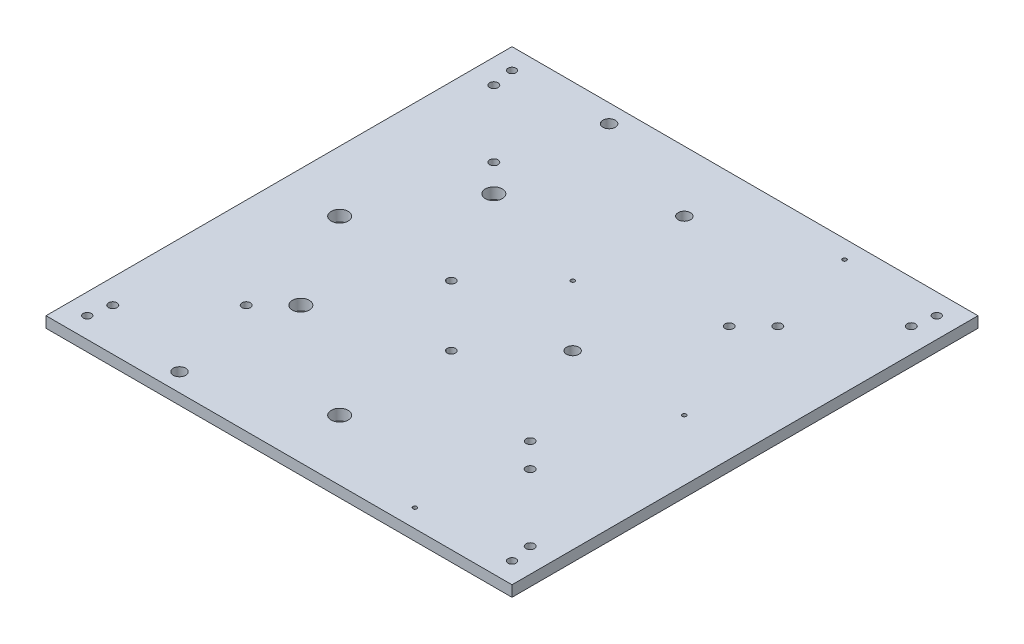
SolidWorks part; units mm, degrees
ref_plane "Front Plane" through (0, 0, 0) normal (0, 0, 1) x (1, 0, 0)
ref_plane "Top Plane" through (0, 0, 0) normal (0, 1, 0) x (1, 0, 0)
ref_plane "Right Plane" through (0, 0, 0) normal (1, 0, 0) x (0, 0, -1)
sketch "Sketch1" plane through (0, 0, 0) normal (0, 1, 0) x (1, 0, 0)
  line L1 (0, 0) -> (384, 0)
  line L2 (0, 0) -> (0, 384)
  line L3 (0, 384) -> (384, 384)
  line L4 (384, 0) -> (384, 384)
  dimension "D1" = 384
  dimension "D2" = 384
extrude "Boss-Extrude1" add sketch "Sketch1" along normal blind 8.99
sketch "Sketch2" plane through (0, 8.99, 0) normal (0, 1, 0) x (1, 0, 0)
  line L0 (0, 0) -> (384, 0) construction
  line L1 (10, 25) -> (85, 25)
  line L2 (10, 25) -> (10, 100)
  line L3 (10, 100) -> (85, 100)
  line L4 (85, 25) -> (85, 100)
  line L5 (0, 384) -> (0, 0) construction
  line L6 (0, 192) -> (384, 192) construction
  line L7 (384, 0) -> (384, 384) construction
  line L8 (192, 384) -> (192, 0) construction
  line L9 (384, 384) -> (0, 384) construction
  line L10 (10, 284) -> (85, 284)
  line L11 (85, 359) -> (85, 284)
  line L12 (10, 359) -> (85, 359)
  line L13 (10, 359) -> (10, 284)
  line L14 (374, 100) -> (299, 100)
  line L15 (299, 25) -> (299, 100)
  line L16 (374, 25) -> (299, 25)
  line L17 (374, 25) -> (374, 100)
  line L18 (374, 359) -> (374, 284)
  line L19 (374, 359) -> (299, 359)
  line L20 (299, 359) -> (299, 284)
  line L21 (374, 284) -> (299, 284)
  dimension "D1" = 75
  dimension "D2" = 75
  dimension "D3" = 25
  dimension "D4" = 10
sketch "Sketch3" plane through (0, 8.99, 0) normal (0, 1, 0) x (1, 0, 0)
  line L8 (0, 192) -> (384, 192) construction
  line L9 (0, 384) -> (0, 0) construction
  line L10 (384, 0) -> (384, 384) construction
  line L11 (192, 384) -> (192, 0) construction
  line L12 (384, 384) -> (0, 384) construction
  line L13 (0, 0) -> (384, 0) construction
  line L14 (85, 359) -> (85, 284) construction
  line L15 (10, 284) -> (85, 284) construction
  line L16 (299, 359) -> (299, 284) construction
  line L17 (374, 284) -> (299, 284) construction
  line L18 (374, 25) -> (299, 25) construction
  line L19 (299, 25) -> (299, 100) construction
  line L20 (85, 25) -> (85, 100) construction
  line L21 (10, 25) -> (85, 25) construction
  circle A0 centre (95, 15) radius 6
  circle A1 centre (97.5, 271.5) radius 8
  circle A2 centre (289, 274) radius 4
  circle A3 centre (289, 15) radius 2
  circle A4 centre (50, 192) radius 8
  circle A5 centre (142, 192) radius 4
  circle A6 centre (242, 192) radius 6
  circle A7 centre (334, 192) radius 2
  dimension "D1" = 12
  dimension "D4" = 16
  dimension "D7" = 8
  dimension "D8" = 4
  dimension "D13" = 16
  dimension "D14" = 8
  dimension "D15" = 12
  dimension "D16" = 4
  dimension "D19" = 50
  dimension "D3" = 10
  dimension "D5" = 12.5
  dimension "D6" = 12.5
  dimension "D9" = 10
  dimension "D10" = 10
  dimension "D11" = 10
  dimension "D12" = 10
  dimension "D17" = 50
  dimension "D18" = 50
  dimension "D20" = 50
  dimension "D21" = 10
sketch "Sketch4" plane through (0, 8.99, 0) normal (0, 1, 0) x (1, 0, 0)
  line L8 (192, 384) -> (192, 0) construction
  line L9 (384, 384) -> (0, 384) construction
  line L10 (0, 0) -> (384, 0) construction
  line L11 (0, 192) -> (384, 192) construction
  line L12 (0, 384) -> (0, 0) construction
  line L13 (384, 0) -> (384, 384) construction
  line L14 (85, 359) -> (85, 284) construction
  line L15 (10, 359) -> (85, 359) construction
  line L16 (299, 359) -> (299, 284) construction
  line L17 (374, 359) -> (299, 359) construction
  line L18 (299, 25) -> (299, 100) construction
  line L19 (374, 100) -> (299, 100) construction
  line L20 (10, 100) -> (85, 100) construction
  line L21 (85, 25) -> (85, 100) construction
  circle A0 centre (97.5, 112.5) radius 8
  circle A1 centre (289, 110) radius 4
  circle A2 centre (289, 369) radius 2
  circle A3 centre (95, 369) radius 6
  circle A5 centre (192, 334) radius 6
  circle A6 centre (192, 242) radius 2
  circle A7 centre (192, 142) radius 4
  circle A8 centre (192, 50) radius 8
  dimension "D9" = 16
  dimension "D10" = 8
  dimension "D11" = 4
  dimension "D12" = 12
  dimension "D13" = 12
  dimension "D14" = 4
  dimension "D15" = 8
  dimension "D16" = 16
  dimension "D3" = 10
  dimension "D4" = 10
  dimension "D5" = 10
  dimension "D6" = 10
  dimension "D7" = 12.5
  dimension "D8" = 12.5
  dimension "D17" = 50
  dimension "D18" = 50
  dimension "D19" = 50
  dimension "D20" = 50
  dimension "D21" = 10
  dimension "D22" = 10
sketch "Sketch5" plane through (0, 8.99, 0) normal (0, 1, 0) x (1, 0, 0)
  line L0 (0, 384) -> (0, 0) construction
  line L1 (384, 384) -> (0, 384) construction
  point P0 (17, 17)
  point P1 (17, 367)
  point P2 (367, 367)
  point P3 (367, 17)
  dimension "D1" = 350
  dimension "D2" = 350
  dimension "D3" = 350
  dimension "D4" = 350
  dimension "D5" = 17
  dimension "D6" = 17
hole_wizard "M6 Clearance Hole1" positions "Sketch5" profile "Sketch6" hole size "M6" standard "ANSI Metric"
sketch "Sketch6" plane through (17, 8.99, -17) normal (1, 0, 0) x (0, 0, 1)
  line L0 (0, 0) -> (0, 8.99)
  line L1 (0, 8.99) -> (3.3, 8.99)
  line L2 (3.3, 8.99) -> (3.3, 0)
  line L5 (3.3, 0) -> (0, 0)
  line L11 (0, -6.35) -> (0, 107.95) construction
  dimension "Thru Hole Dia." = 6.6
  dimension "Thru Hole Depth" = 8.99
sketch "M16_Sketch" plane through (0, 8.99, 0) normal (0, 1, 0) x (1, 0, 0)
  point P0 (50, 192)
  point P1 (97.5, 271.5)
  point P3 (192, 50)
  point P5 (97.5, 112.5)
sketch "M12_Sketch" plane through (0, 8.99, 0) normal (0, 1, 0) x (1, 0, 0)
  point P0 (242, 192)
  point P1 (192, 334)
  point P3 (95, 369)
  point P5 (95, 15)
sketch "M8_Sketch" plane through (0, 8.99, 0) normal (0, 1, 0) x (1, 0, 0)
  point P0 (142, 192)
  point P1 (289, 110)
  point P3 (289, 274)
  point P5 (192, 142)
sketch "M4_Sketch" plane through (0, 8.99, 0) normal (0, 1, 0) x (1, 0, 0)
  point P0 (192, 242)
  point P1 (334, 192)
  point P3 (289, 369)
  point P5 (289, 15)
hole_wizard "Tap Drill for M8x1.25 Tap1" positions "M8_Sketch" profile "Sketch14" hole size "M8x1.25" standard "ANSI Metric"
sketch "Sketch14" plane through (142, 8.99, -192) normal (1, 0, 0) x (0, 0, 1)
  line L0 (0, 0) -> (0, 8.99)
  line L1 (0, 8.99) -> (3.4, 8.99)
  line L2 (3.4, 8.99) -> (3.4, 0)
  line L5 (3.4, 0) -> (0, 0)
  line L11 (0, -6.35) -> (0, 107.95) construction
  dimension "Thru Hole Dia." = 6.8
  dimension "Thru Hole Depth" = 8.99
hole_wizard "Tap Drill for M4x0.7 Tap1" positions "M4_Sketch" profile "Sketch15" hole size "M4x0.7" standard "ANSI Metric"
sketch "Sketch15" plane through (192, 8.99, -242) normal (1, 0, 0) x (0, 0, 1)
  line L0 (0, 0) -> (0, 8.99)
  line L1 (0, 8.99) -> (1.65, 8.99)
  line L2 (1.65, 8.99) -> (1.65, 0)
  line L5 (1.65, 0) -> (0, 0)
  line L11 (0, -6.35) -> (0, 107.95) construction
  dimension "Thru Hole Dia." = 3.3
  dimension "Thru Hole Depth" = 8.99
hole_wizard "Tap Drill for M12x1.75 Tap1" positions "M12_Sketch" profile "Sketch16" hole size "M12x1.75" standard "ANSI Metric"
sketch "Sketch16" plane through (242, 8.99, -192) normal (1, 0, 0) x (0, 0, 1)
  line L0 (0, 0) -> (0, 8.99)
  line L1 (0, 8.99) -> (5.1, 8.99)
  line L2 (5.1, 8.99) -> (5.1, 0)
  line L5 (5.1, 0) -> (0, 0)
  line L11 (0, -6.35) -> (0, 107.95) construction
  dimension "Thru Hole Dia." = 10.2
  dimension "Thru Hole Depth" = 8.99
hole_wizard "Tap Drill for M16x2.0 Tap1" positions "M16_Sketch" profile "Sketch17" hole size "M16x2.0" standard "ANSI Metric"
sketch "Sketch17" plane through (50, 8.99, -192) normal (1, 0, 0) x (0, 0, 1)
  line L0 (0, 0) -> (0, 8.99)
  line L1 (0, 8.99) -> (7, 8.99)
  line L2 (7, 8.99) -> (7, 0)
  line L5 (7, 0) -> (0, 0)
  line L11 (0, -6.35) -> (0, 107.95) construction
  dimension "Thru Hole Dia." = 14
  dimension "Thru Hole Depth" = 8.99
sketch "Sketch18" plane through (0, 8.99, 0) normal (0, 1, 0) x (1, 0, 0)
  line L0 (10, 359) -> (85, 359) construction
  line L1 (10, 359) -> (10, 284) construction
  line L2 (10, 284) -> (85, 284) construction
  line L3 (85, 359) -> (85, 284) construction
  line L4 (0, 192) -> (384, 192) construction
  line L5 (192, 384) -> (192, 0) construction
  line L6 (0, 192) -> (384, 192) construction
  line L7 (192, 384) -> (192, 0) construction
  point P0 (20, 349)
  point P1 (75, 294)
  point P14 (364, 349)
  point P15 (309, 294)
  point P16 (364, 35)
  point P17 (309, 90)
  point P18 (20, 35)
  point P19 (75, 90)
  dimension "D1" = 10
  dimension "D2" = 10
  dimension "D3" = 10
  dimension "D4" = 10
hole_wizard "M6 Clearance Hole2" hole size "M6" standard "ANSI Metric"
sketch "Sketch19" plane through (20, 8.99, -349) normal (1, 0, 0) x (0, 0, 1)
  line L0 (0, 0) -> (0, 8.99)
  line L1 (0, 8.99) -> (3.5, 8.99)
  line L2 (3.5, 8.99) -> (3.5, 0)
  line L5 (3.5, 0) -> (0, 0)
  line L11 (0, -6.35) -> (0, 107.95) construction
  dimension "Thru Hole Dia." = 7
  dimension "Thru Hole Depth" = 8.99
